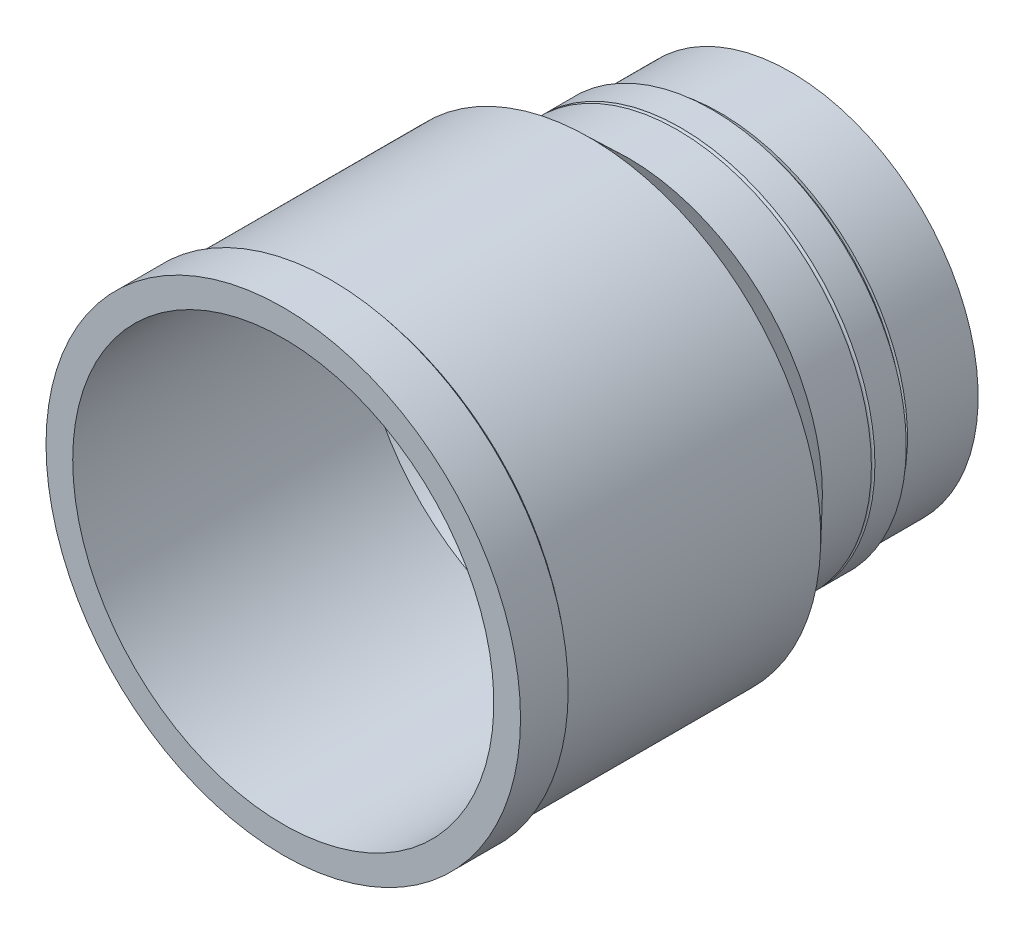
SolidWorks part; units mm, degrees
ref_plane "Front Plane" through (0, 0, 0) normal (0, 0, 1) x (1, 0, 0)
ref_plane "Top Plane" through (0, 0, 0) normal (0, 1, 0) x (1, 0, 0)
ref_plane "Right Plane" through (0, 0, 0) normal (1, 0, 0) x (0, 0, -1)
sketch "Sketch1" plane through (0, 0, 0) normal (1, 0, 0) x (0, 0, -1)
  line L0 (254, 97.842) -> (254, 84.7165)
  line L1 (0, 136.5885) -> (0, 121.2129)
  line L2 (226.822, 111.76) -> (198.628, 111.76)
  line L3 (243.84, 111.76) -> (228.854, 111.76)
  line L4 (246.888, 111.76) -> (246.888, 106.0724)
  line L5 (246.888, 106.0724) -> (251.4092, 106.0724)
  line L6 (251.4092, 106.0724) -> (251.4092, 107.95)
  line L7 (251.4092, 107.95) -> (292.1, 107.95)
  line L8 (292.1, 107.95) -> (292.1, 97.842)
  line L9 (87.9139, 0) -> (0, 0)
  line L10 (0, 0) -> (0.4167, -0.4167)
  line L13 (228.6, 84.7165) -> (164.5942, 121.2129)
  line L14 (164.5942, 121.2129) -> (0, 121.2129)
  line L15 (254, 97.842) -> (292.1, 97.842)
  line L17 (254, 84.7165) -> (228.6, 84.7165)
  line L20 (176.53, 132.9055) -> (30.48, 132.9055)
  line L21 (198.628, 111.76) -> (176.53, 132.9055)
  line L23 (228.854, 111.76) -> (246.888, 111.76)
  line L25 (0, 136.5885) -> (27.432, 136.5885)
  line L26 (27.432, 136.5885) -> (30.48, 132.9055)
  arc A0 (226.822, 111.76) -> (228.854, 111.76) centre (227.838, 111.76) ccw
  dimension "D9" = 1.016
  dimension "D18" = 38.1
  dimension "D2" = 107.95
  dimension "D3" = 4.5212
  dimension "D4" = 164.5942
  dimension "D5" = 45.212
  dimension "D6" = 111.76
  dimension "D7" = 48.26
  dimension "D8" = 48.26
  dimension "D10" = 19.05
  dimension "D11" = 149.098
  dimension "D12" = 146.05
  dimension "D13" = 136.5885
  dimension "D14" = 132.9055
  dimension "D15" = 292.1
  dimension "D16" = 70.358
  dimension "D17" = 5.6876
  dimension "D19" = 292.1
  dimension "D20" = 73.6799
  dimension "D21" = 25.4
  dimension "D22" = 84.7165
  dimension "D23" = 97.842
sketch "Sketch3" plane through (0, 0, 0) normal (1, 0, 0) x (0, 0, -1)
  line L1 (71.2886, 101.6) -> (71.2886, 76.3966)
  line L4 (147.6852, 0) -> (172.8886, 0)
  arc A0 (172.8886, 0) -> (71.2886, 101.6) centre (71.2886, 0) ccw
  arc A1 (147.6852, 0) -> (71.2886, 76.3966) centre (71.2886, 0) ccw
  dimension "D1" = 101.6
revolve "Revolve1" [suppressed] add sketch "Sketch3" angle 360 about L4
revolve "Revolve2" add sketch "Sketch1" angle 360 about L9
